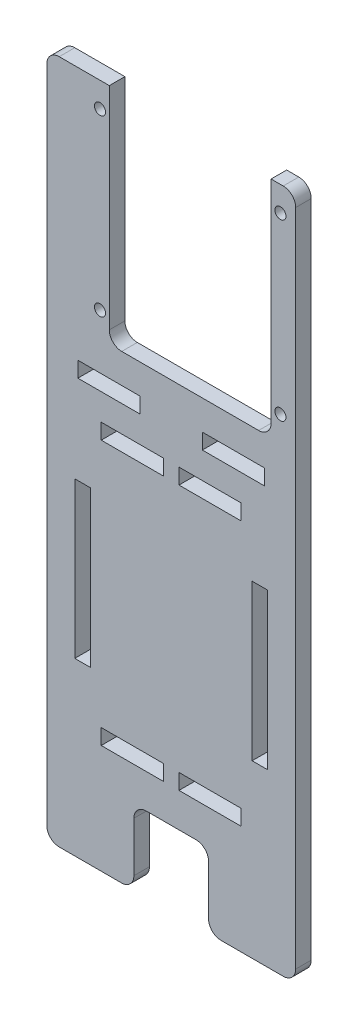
SolidWorks part; units mm, degrees
ref_plane "Front Plane" through (0, 0, 0) normal (0, 0, 1) x (1, 0, 0)
ref_plane "Top Plane" through (0, 0, 0) normal (0, 1, 0) x (1, 0, 0)
ref_plane "Right Plane" through (0, 0, 0) normal (1, 0, 0) x (0, 0, -1)
sketch "Sketch1" plane through (0, 0, 0) normal (0, 0, 1) x (1, 0, 0)
  line L1 (-25.4, -69.85) -> (25.4, -69.85)
  line L2 (-25.4, -69.85) -> (-25.4, 69.85)
  line L3 (-25.4, 69.85) -> (25.4, 69.85)
  line L4 (25.4, -69.85) -> (25.4, 69.85)
  line L5 (-25.4, -69.85) -> (25.4, 69.85) construction
  line L6 (-25.4, 69.85) -> (25.4, -69.85) construction
  point P0 (0, 0)
  dimension "D1" = 139.7
  dimension "D2" = 50.8
extrude "Boss-Extrude1" add sketch "Sketch1" along normal blind 3.175
sketch "Sketch3" plane through (0, 0, 3.175) normal (0, 0, 1) x (1, 0, 0)
  line L0 (0, -69.85) -> (0, 0.6319) construction
  line L1 (-25.4, -69.85) -> (25.4, -69.85) construction
  line L3 (-7.62, -54.61) -> (7.62, -54.61)
  line L4 (-7.62, -54.61) -> (-7.62, -92.71)
  line L5 (-7.62, -92.71) -> (7.62, -92.71)
  line L6 (7.62, -54.61) -> (7.62, -92.71)
  line L7 (-7.62, -54.61) -> (7.62, -92.71) construction
  line L8 (-7.62, -92.71) -> (7.62, -54.61) construction
  point P5 (0, -73.66)
  dimension "D1" = 38.1
  dimension "D2" = 15.24
  dimension "D3" = 22.86
extrude "Cut-Extrude2" cut sketch "Sketch3" against normal through all
sketch "Sketch22" plane through (0, 0, 3.175) normal (0, 0, 1) x (1, 0, 0)
  line L0 (25.4, 69.85) -> (-25.4, 69.85) construction
  line L1 (-12.6375, 69.85) -> (20.3825, 69.85)
  line L2 (-12.6375, 69.85) -> (-12.6375, 24.13)
  line L3 (-12.6375, 24.13) -> (20.3825, 24.13)
  line L4 (20.3825, 69.85) -> (20.3825, 24.13)
  line L5 (-12.6375, 69.85) -> (20.3825, 24.13) construction
  line L6 (-12.6375, 24.13) -> (20.3825, 69.85) construction
  line L7 (0, 0) -> (0, 122.4243) construction
  point P0 (3.8725, 46.99)
  dimension "D1" = 33.02
  dimension "D2" = 45.72
  dimension "D3" = 22.86
  dimension "D4" = 3.8725
extrude "Cut-Extrude8" cut sketch "Sketch22" against normal through all
hole_wizard "#2 Clearance Hole1" positions "Sketch24" profile "Sketch25" hole size "#2" standard "ANSI Inch"
sketch "Sketch24" plane through (0, 0, 3.175) normal (0, 0, 1) x (1, 0, 0)
  line L0 (22.2875, 69.85) -> (22.2875, 79.055) construction
  line L1 (25.4, 69.85) -> (20.3825, 69.85) construction
  line L3 (-14.5425, 69.85) -> (-14.5425, 79.5197) construction
  line L4 (-12.6375, 69.85) -> (-25.4, 69.85) construction
  line L6 (-25.4, 64.77) -> (25.4, 64.77) construction
  line L7 (-25.4, 69.85) -> (-25.4, -69.85) construction
  line L8 (25.4, -69.85) -> (25.4, 69.85) construction
  line L10 (-25.4, 29.21) -> (25.4, 29.21) construction
  line L12 (20.3825, 24.13) -> (20.3825, 69.85) construction
  line L14 (-12.6375, 69.85) -> (-12.6375, 24.13) construction
  line L15 (-12.6375, 24.13) -> (20.3825, 24.13) construction
  point P32 (-14.5425, 64.77)
  point P34 (-14.5425, 29.21)
  point P36 (22.2875, 64.77)
  point P38 (22.2875, 29.21)
  dimension "D1" = 5.08
  dimension "D2" = 1.905
  dimension "D3" = 1.905
  dimension "D4" = 5.08
sketch "Sketch25" plane through (22.2875, 29.21, 3.175) normal (1, 0, 0) x (0, -1, 0)
  line L0 (0, 0) -> (0, 3.175)
  line L1 (0, 3.175) -> (1.1303, 3.175)
  line L2 (1.1303, 3.175) -> (1.1303, 0)
  line L5 (1.1303, 0) -> (0, 0)
  line L11 (0, -6.35) -> (0, 107.95) construction
  dimension "Thru Hole Dia." = 2.2606
  dimension "Thru Hole Depth" = 3.175
fillet "Fillet1" radius 2.54 10 edges at (20.3825, 24.13, 1.5875) (-12.6375, 24.13, 1.5875) (-25.4, 69.85, 1.5875) (25.4, 69.85, 1.5875) (-25.4, -69.85, 1.5875) (25.4, -69.85, 1.5875) (-7.62, -54.61, 1.5875) (-7.62, -69.85, 1.5875) (7.62, -69.85, 1.5875) (7.62, -54.61, 1.5875)
sketch "Sketch26" plane through (0, 0, 3.175) normal (0, 0, 1) x (1, 0, 0)
  line L0 (0, 0) -> (0, -75.1956) construction
  line L1 (0, 0) -> (23.1244, 0) construction
  line L2 (-20.2138, -19.05) -> (21.3275, -19.05) construction
  line L3 (7.9375, -18.5177) -> (7.9375, -58.8203) construction
  line L4 (16.51, -3.175) -> (19.685, -3.175)
  line L5 (16.51, -3.175) -> (16.51, -34.925)
  line L6 (16.51, -34.925) -> (19.685, -34.925)
  line L7 (19.685, -3.175) -> (19.685, -34.925)
  line L8 (16.51, -3.175) -> (19.685, -34.925) construction
  line L9 (16.51, -34.925) -> (19.685, -3.175) construction
  line L10 (-16.51, -34.925) -> (-19.685, -3.175) construction
  line L11 (1.5875, -44.45) -> (14.2875, -44.45)
  line L12 (1.5875, -44.45) -> (1.5875, -47.625)
  line L13 (1.5875, -47.625) -> (14.2875, -47.625)
  line L14 (14.2875, -44.45) -> (14.2875, -47.625)
  line L15 (1.5875, -44.45) -> (14.2875, -47.625) construction
  line L16 (1.5875, -47.625) -> (14.2875, -44.45) construction
  line L17 (-16.51, -3.175) -> (-19.685, -34.925) construction
  line L18 (-19.685, -3.175) -> (-19.685, -34.925)
  line L19 (-16.51, -34.925) -> (-19.685, -34.925)
  line L20 (-16.51, -3.175) -> (-16.51, -34.925)
  line L21 (-16.51, -3.175) -> (-19.685, -3.175)
  line L22 (-1.5875, -47.625) -> (-14.2875, -44.45) construction
  line L23 (-1.5875, -44.45) -> (-14.2875, -47.625) construction
  line L24 (-7.9375, -18.5177) -> (-7.9375, -58.8203) construction
  line L25 (-14.2875, -44.45) -> (-14.2875, -47.625)
  line L26 (-1.5875, -47.625) -> (-14.2875, -47.625)
  line L27 (-1.5875, -44.45) -> (-1.5875, -47.625)
  line L28 (-1.5875, -44.45) -> (-14.2875, -44.45)
  line L29 (-1.5875, 6.35) -> (-14.2875, 9.525) construction
  line L30 (-1.5875, 9.525) -> (-14.2875, 6.35) construction
  line L31 (1.5875, 9.525) -> (14.2875, 6.35) construction
  line L32 (1.5875, 6.35) -> (14.2875, 9.525) construction
  line L33 (-1.5875, 6.35) -> (-14.2875, 6.35)
  line L34 (-1.5875, 6.35) -> (-1.5875, 9.525)
  line L35 (-1.5875, 9.525) -> (-14.2875, 9.525)
  line L36 (-14.2875, 6.35) -> (-14.2875, 9.525)
  line L37 (14.2875, 6.35) -> (14.2875, 9.525)
  line L38 (1.5875, 9.525) -> (14.2875, 9.525)
  line L39 (1.5875, 6.35) -> (1.5875, 9.525)
  line L40 (1.5875, 6.35) -> (14.2875, 6.35)
  point P7 (18.0975, -19.05)
  point P13 (7.9375, -46.0375)
  point P22 (-18.0975, -19.05)
  point P29 (-7.9375, -46.0375)
  point P38 (-7.9375, 7.9375)
  point P39 (7.9375, 7.9375)
extrude "Cut-Extrude9" cut sketch "Sketch26" against normal through all
sketch "Sketch27" plane through (0, 0, 3.175) normal (0, 0, 1) x (1, 0, 0)
  line L0 (0, 0) -> (0, 39.0224) construction
  line L1 (-31.7319, 16.51) -> (33.2642, 16.51) construction
  line L2 (-6.35, 14.9225) -> (-19.05, 18.0975) construction
  line L3 (6.35, 18.0975) -> (19.05, 18.0975)
  line L4 (6.35, 18.0975) -> (6.35, 14.9225)
  line L5 (6.35, 14.9225) -> (19.05, 14.9225)
  line L6 (19.05, 18.0975) -> (19.05, 14.9225)
  line L7 (6.35, 18.0975) -> (19.05, 14.9225) construction
  line L8 (6.35, 14.9225) -> (19.05, 18.0975) construction
  line L9 (-6.35, 18.0975) -> (-19.05, 14.9225) construction
  line L10 (31.7319, 16.51) -> (-33.2642, 16.51) construction
  line L11 (-19.05, 18.0975) -> (-19.05, 14.9225)
  line L12 (-6.35, 14.9225) -> (-19.05, 14.9225)
  line L13 (-6.35, 18.0975) -> (-6.35, 14.9225)
  line L14 (-6.35, 18.0975) -> (-19.05, 18.0975)
  line L15 (-10.0975, 24.13) -> (17.8425, 24.13) construction
  point P5 (12.7, 16.51)
  point P16 (-12.7, 16.51)
extrude "Cut-Extrude10" cut sketch "Sketch27" against normal through all
sketch "Sketch28" plane through (0, 0, 3.175) normal (0, 0, 1) x (1, 0, 0)
  line L32 (-18.9484, 15.0241) -> (-6.4516, 15.0241)
  line L33 (-6.4516, 15.0241) -> (-6.4516, 17.9959)
  line L34 (-18.9484, 17.9959) -> (-18.9484, 15.0241)
  line L35 (-6.4516, 17.9959) -> (-18.9484, 17.9959)
  line L36 (-12.5359, 69.9516) -> (-22.86, 69.9516)
  line L37 (-25.5016, 67.31) -> (-25.5016, -67.31)
  line L38 (-22.86, -69.9516) -> (-10.16, -69.9516)
  line L39 (-7.5184, -67.31) -> (-7.5184, -57.15)
  line L40 (-5.08, -54.7116) -> (5.08, -54.7116)
  line L41 (7.5184, -57.15) -> (7.5184, -67.31)
  line L42 (10.16, -69.9516) -> (22.86, -69.9516)
  line L43 (25.5016, -67.31) -> (25.5016, 67.31)
  line L44 (22.86, 69.9516) -> (20.2809, 69.9516)
  line L45 (20.2809, 69.9516) -> (20.2809, 26.67)
  line L46 (17.8425, 24.2316) -> (-10.0975, 24.2316)
  line L47 (-12.5359, 26.67) -> (-12.5359, 69.9516)
  line L48 (-12.5359, 69.9516) -> (-22.86, 69.9516)
  line L49 (-25.5016, 67.31) -> (-25.5016, -67.31)
  line L50 (-22.86, -69.9516) -> (-10.16, -69.9516)
  line L51 (-7.5184, -67.31) -> (-7.5184, -57.15)
  line L52 (-5.08, -54.7116) -> (5.08, -54.7116)
  line L53 (7.5184, -57.15) -> (7.5184, -67.31)
  line L54 (10.16, -69.9516) -> (22.86, -69.9516)
  line L55 (25.5016, -67.31) -> (25.5016, 67.31)
  line L56 (22.86, 69.9516) -> (20.2809, 69.9516)
  line L57 (20.2809, 69.9516) -> (20.2809, 26.67)
  line L58 (17.8425, 24.2316) -> (-10.0975, 24.2316)
  line L59 (-12.5359, 26.67) -> (-12.5359, 69.9516)
  line L60 (-18.9484, 15.0241) -> (-6.4516, 15.0241)
  line L61 (-6.4516, 15.0241) -> (-6.4516, 17.9959)
  line L62 (-18.9484, 17.9959) -> (-18.9484, 15.0241)
  line L63 (-6.4516, 17.9959) -> (-18.9484, 17.9959)
  line L68 (18.9484, 15.0241) -> (18.9484, 17.9959)
  line L69 (18.9484, 17.9959) -> (6.4516, 17.9959)
  line L70 (6.4516, 17.9959) -> (6.4516, 15.0241)
  line L71 (6.4516, 15.0241) -> (18.9484, 15.0241)
  line L72 (18.9484, 15.0241) -> (18.9484, 17.9959)
  line L73 (18.9484, 17.9959) -> (6.4516, 17.9959)
  line L74 (6.4516, 17.9959) -> (6.4516, 15.0241)
  line L75 (6.4516, 15.0241) -> (18.9484, 15.0241)
  line L80 (-1.6891, 6.4516) -> (-1.6891, 9.4234)
  line L81 (-1.6891, 9.4234) -> (-14.1859, 9.4234)
  line L82 (-14.1859, 9.4234) -> (-14.1859, 6.4516)
  line L83 (-14.1859, 6.4516) -> (-1.6891, 6.4516)
  line L84 (-1.6891, 6.4516) -> (-1.6891, 9.4234)
  line L85 (-1.6891, 9.4234) -> (-14.1859, 9.4234)
  line L86 (-14.1859, 9.4234) -> (-14.1859, 6.4516)
  line L87 (-14.1859, 6.4516) -> (-1.6891, 6.4516)
  line L92 (1.6891, 9.4234) -> (1.6891, 6.4516)
  line L93 (14.1859, 9.4234) -> (1.6891, 9.4234)
  line L94 (14.1859, 6.4516) -> (14.1859, 9.4234)
  line L95 (1.6891, 6.4516) -> (14.1859, 6.4516)
  line L96 (1.6891, 9.4234) -> (1.6891, 6.4516)
  line L97 (14.1859, 9.4234) -> (1.6891, 9.4234)
  line L98 (14.1859, 6.4516) -> (14.1859, 9.4234)
  line L99 (1.6891, 6.4516) -> (14.1859, 6.4516)
  line L104 (-16.6116, -3.2766) -> (-19.5834, -3.2766)
  line L105 (-19.5834, -34.8234) -> (-16.6116, -34.8234)
  line L106 (-16.6116, -34.8234) -> (-16.6116, -3.2766)
  line L107 (-19.5834, -3.2766) -> (-19.5834, -34.8234)
  line L108 (-16.6116, -3.2766) -> (-19.5834, -3.2766)
  line L109 (-19.5834, -34.8234) -> (-16.6116, -34.8234)
  line L110 (-16.6116, -34.8234) -> (-16.6116, -3.2766)
  line L111 (-19.5834, -3.2766) -> (-19.5834, -34.8234)
  line L116 (16.6116, -34.8234) -> (19.5834, -34.8234)
  line L117 (19.5834, -3.2766) -> (16.6116, -3.2766)
  line L118 (19.5834, -34.8234) -> (19.5834, -3.2766)
  line L119 (16.6116, -3.2766) -> (16.6116, -34.8234)
  line L120 (16.6116, -34.8234) -> (19.5834, -34.8234)
  line L121 (19.5834, -3.2766) -> (16.6116, -3.2766)
  line L122 (19.5834, -34.8234) -> (19.5834, -3.2766)
  line L123 (16.6116, -3.2766) -> (16.6116, -34.8234)
  line L128 (-14.1859, -47.5234) -> (-1.6891, -47.5234)
  line L129 (-1.6891, -47.5234) -> (-1.6891, -44.5516)
  line L130 (-14.1859, -44.5516) -> (-14.1859, -47.5234)
  line L131 (-1.6891, -44.5516) -> (-14.1859, -44.5516)
  line L132 (-14.1859, -47.5234) -> (-1.6891, -47.5234)
  line L133 (-1.6891, -47.5234) -> (-1.6891, -44.5516)
  line L134 (-14.1859, -44.5516) -> (-14.1859, -47.5234)
  line L135 (-1.6891, -44.5516) -> (-14.1859, -44.5516)
  line L140 (1.6891, -44.5516) -> (1.6891, -47.5234)
  line L141 (14.1859, -44.5516) -> (1.6891, -44.5516)
  line L142 (14.1859, -47.5234) -> (14.1859, -44.5516)
  line L143 (1.6891, -47.5234) -> (14.1859, -47.5234)
  line L144 (1.6891, -44.5516) -> (1.6891, -47.5234)
  line L145 (14.1859, -44.5516) -> (1.6891, -44.5516)
  line L146 (14.1859, -47.5234) -> (14.1859, -44.5516)
  line L147 (1.6891, -47.5234) -> (14.1859, -47.5234)
  circle A22 centre (-14.5425, 64.77) radius 1.0287
  circle A23 centre (-14.5425, 64.77) radius 1.0287
  circle A25 centre (22.2875, 64.77) radius 1.0287
  circle A26 centre (22.2875, 64.77) radius 1.0287
  circle A28 centre (-14.5425, 29.21) radius 1.0287
  circle A29 centre (-14.5425, 29.21) radius 1.0287
  arc A30 (-22.86, 69.9516) -> (-25.5016, 67.31) centre (-22.86, 67.31) ccw
  arc A31 (-25.5016, -67.31) -> (-22.86, -69.9516) centre (-22.86, -67.31) ccw
  arc A32 (-10.16, -69.9516) -> (-7.5184, -67.31) centre (-10.16, -67.31) ccw
  arc A33 (-5.08, -54.7116) -> (-7.5184, -57.15) centre (-5.08, -57.15) ccw
  arc A34 (7.5184, -57.15) -> (5.08, -54.7116) centre (5.08, -57.15) ccw
  arc A35 (7.5184, -67.31) -> (10.16, -69.9516) centre (10.16, -67.31) ccw
  arc A36 (22.86, -69.9516) -> (25.5016, -67.31) centre (22.86, -67.31) ccw
  arc A37 (25.5016, 67.31) -> (22.86, 69.9516) centre (22.86, 67.31) ccw
  arc A38 (17.8425, 24.2316) -> (20.2809, 26.67) centre (17.8425, 26.67) ccw
  arc A39 (-12.5359, 26.67) -> (-10.0975, 24.2316) centre (-10.0975, 26.67) ccw
  arc A40 (-22.86, 69.9516) -> (-25.5016, 67.31) centre (-22.86, 67.31) ccw
  arc A41 (-25.5016, -67.31) -> (-22.86, -69.9516) centre (-22.86, -67.31) ccw
  arc A42 (-10.16, -69.9516) -> (-7.5184, -67.31) centre (-10.16, -67.31) ccw
  arc A43 (-5.08, -54.7116) -> (-7.5184, -57.15) centre (-5.08, -57.15) ccw
  arc A44 (7.5184, -57.15) -> (5.08, -54.7116) centre (5.08, -57.15) ccw
  arc A45 (7.5184, -67.31) -> (10.16, -69.9516) centre (10.16, -67.31) ccw
  arc A46 (22.86, -69.9516) -> (25.5016, -67.31) centre (22.86, -67.31) ccw
  arc A47 (25.5016, 67.31) -> (22.86, 69.9516) centre (22.86, 67.31) ccw
  arc A48 (17.8425, 24.2316) -> (20.2809, 26.67) centre (17.8425, 26.67) ccw
  arc A49 (-12.5359, 26.67) -> (-10.0975, 24.2316) centre (-10.0975, 26.67) ccw
  circle A51 centre (22.2875, 29.21) radius 1.0287
  circle A52 centre (22.2875, 29.21) radius 1.0287
equation "\"D5@Sketch26\"=1/16+1.3/2"
equation "\"D6@Sketch26\"=1/16+1"
equation "\"D7@Sketch26\"=1/16+.25"
equation "\"t\" = .125in'plywood thickness"
equation "\"kerf\"= .004in'laser cutter kerf"
equation "\"D1@Boss-Extrude1\"=\"t\""
equation "\"D1@Sketch28\"=\"kerf\""
equation "\"D2@Sketch28\"=\"kerf\""
equation "\"D3@Sketch28\"=\"kerf\""
equation "\"D4@Sketch28\"=\"kerf\""
equation "\"D5@Sketch28\"=\"kerf\""
equation "\"D6@Sketch28\"=\"kerf\""
equation "\"D7@Sketch28\"=\"kerf\""
equation "\"D9@Sketch28\"=\"kerf\""
equation "\"D8@Sketch28\"=\"kerf\""
equation "\"D10@Sketch28\"=\"kerf\""
equation "\"D11@Sketch28\"=\"kerf\""
equation "\"D12@Sketch28\"=\"kerf\""
equation "\"D13@Sketch28\"=\"kerf\""
equation "\"D4@Sketch27\"=\"t\""
